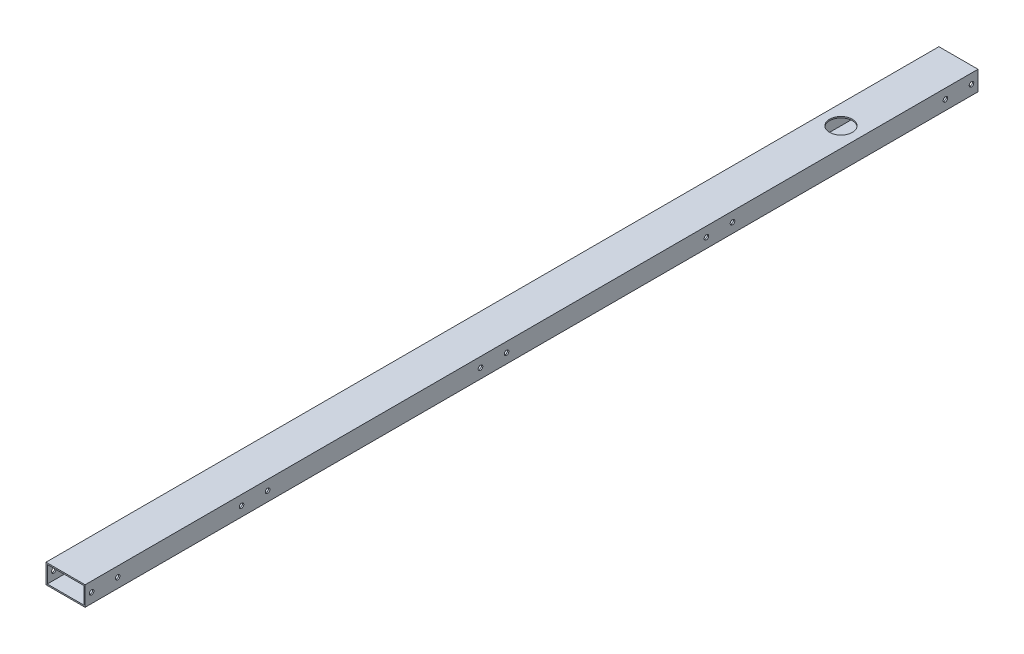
SolidWorks part; units mm, degrees
ref_plane "Front Plane" through (0, 0, 0) normal (0, 0, 1) x (1, 0, 0)
ref_plane "Top Plane" through (0, 0, 0) normal (0, 1, 0) x (1, 0, 0)
ref_plane "Right Plane" through (0, 0, 0) normal (1, 0, 0) x (0, 0, -1)
sketch "Sketch1" plane through (0, 0, 2518.8599) normal (0, 0, -1) x (-1, 0, 0)
  line L1 (-597.3655, 1572.8582) -> (-537.3655, 1572.8582)
  line L2 (-597.3655, 1572.8582) -> (-597.3655, 1602.8582)
  line L3 (-597.3655, 1602.8582) -> (-537.3655, 1602.8582)
  line L4 (-537.3655, 1572.8582) -> (-537.3655, 1602.8582)
  line L5 (-597.3655, 1572.8582) -> (-537.3655, 1602.8582) construction
  line L6 (-597.3655, 1602.8582) -> (-537.3655, 1572.8582) construction
  line L11 (-595.3655, 1600.8582) -> (-539.3655, 1600.8582)
  line L12 (-539.3655, 1574.8582) -> (-539.3655, 1600.8582)
  line L13 (-595.3655, 1574.8582) -> (-539.3655, 1574.8582)
  line L14 (-595.3655, 1574.8582) -> (-595.3655, 1600.8582)
  point P4 (-567.3655, 1587.8582)
  point P10 (-567.3655, 1587.8582)
  dimension "D1" = 30
  dimension "D2" = 60
  dimension "D3" = 2
extrude "Boss-Extrude1" add sketch "Sketch1" against normal blind 1370
sketch "Sketch2" plane through (597.3655, 718.7272, 0) normal (-1, 0, 0) x (0, 1, 0)
  line L1 (869.131, -2528.8599) -> (869.131, -2568.8599) construction
  line L2 (869.131, -2568.8599) -> (869.131, -2915.5266) construction
  line L3 (869.131, -2915.5266) -> (869.131, -3262.1932) construction
  line L4 (869.131, -3262.1932) -> (869.131, -3608.8599) construction
  line L5 (869.131, -3608.8599) -> (869.131, -3648.8599) construction
  line L6 (869.131, -3648.8599) -> (869.131, -3878.8599) construction
  line L8 (869.131, -2528.8599) -> (869.131, -2518.8599) construction
  line L10 (854.131, -2518.8599) -> (884.131, -2518.8599) construction
  line L11 (854.131, -2518.8599) -> (884.131, -2518.8599) construction
  circle A0 centre (869.131, -3838.8599) radius 3.5
  circle A1 centre (869.131, -3242.1932) radius 3.5
  circle A2 centre (869.131, -3282.1932) radius 3.5
  circle A3 centre (869.131, -2895.5266) radius 3.5
  circle A4 centre (869.131, -2935.5266) radius 3.5
  circle A14 centre (869.131, -3878.8599) radius 3.5
  circle A16 centre (869.131, -3648.8599) radius 3.5
  circle A18 centre (869.131, -3608.8599) radius 3.5
  circle A20 centre (869.131, -3262.1932) radius 3.5 construction
  circle A23 centre (869.131, -2915.5266) radius 3.5 construction
  circle A26 centre (869.131, -2528.8599) radius 3.5
  circle A27 centre (869.131, -2568.8599) radius 3.5
extrude "Cut-Extrude3" cut sketch "Sketch2" along normal through all
sketch "Sketch4" plane through (537.3655, 0, 0) normal (-1, 0, 0) x (0, 0, 1)
  line L0 (2528.8599, 1587.8582) -> (2568.8599, 1587.8582) construction
  line L1 (2568.8599, 1587.8582) -> (2915.5266, 1587.8582) construction
  line L2 (2915.5266, 1587.8582) -> (3262.1932, 1587.8582) construction
  line L3 (3262.1932, 1587.8582) -> (3608.8599, 1587.8582) construction
  line L4 (3608.8599, 1587.8582) -> (3648.8599, 1587.8582) construction
  line L5 (3648.8599, 1587.8582) -> (3878.8599, 1587.8582) construction
  line L7 (2528.8599, 1587.8582) -> (2568.8599, 1587.8582) construction
  line L8 (2568.8599, 1587.8582) -> (2915.5266, 1587.8582) construction
  line L9 (2915.5266, 1587.8582) -> (3262.1932, 1587.8582) construction
  line L10 (3262.1932, 1587.8582) -> (3608.8599, 1587.8582) construction
  line L11 (3608.8599, 1587.8582) -> (3648.8599, 1587.8582) construction
  line L12 (3648.8599, 1587.8582) -> (3878.8599, 1587.8582) construction
  circle A0 centre (2895.5266, 1587.8582) radius 10
  circle A1 centre (2935.5266, 1587.8582) radius 10
  circle A2 centre (3648.8599, 1587.8582) radius 10
  circle A3 centre (3242.1932, 1587.8582) radius 10
  circle A5 centre (3282.1932, 1587.8582) radius 10
  circle A6 centre (2568.8599, 1587.8582) radius 10
  circle A7 centre (3838.8599, 1587.8582) radius 10
  circle A8 centre (2528.8599, 1587.8582) radius 3.5
  circle A14 centre (3608.8599, 1587.8582) radius 10
  dimension "D1" = 20
  dimension "D2" = 7
sketch "Sketch5" plane through (0, 1572.8582, 0) normal (0, -1, 0) x (1, 0, 0)
  line L0 (539.3655, 2518.8599) -> (595.3655, 2518.8599) construction
  line L1 (537.3655, 2699.1097) -> (597.3655, 2699.1097) construction
  line L2 (537.3655, 3888.8599) -> (537.3655, 2518.8599) construction
  line L3 (597.3655, 3888.8599) -> (597.3655, 2518.8599) construction
  circle A0 centre (622.3655, 2548.8599) radius 60 construction
  circle A1 centre (567.3655, 2699.1097) radius 17.5
  point P13 (567.3655, 2699.1097)
  dimension "D1" = 30
  dimension "D2" = 120
  dimension "D4" = 160
  dimension "D5" = 35
  dimension "D3" = 25
extrude "Cut-Extrude5" cut sketch "Sketch5" against normal through all
extrude "Cut-Extrude6" cut sketch "Sketch4" against normal blind 3 and the other way through all
equation "\"D3@Sketch2\"=1040/3"
